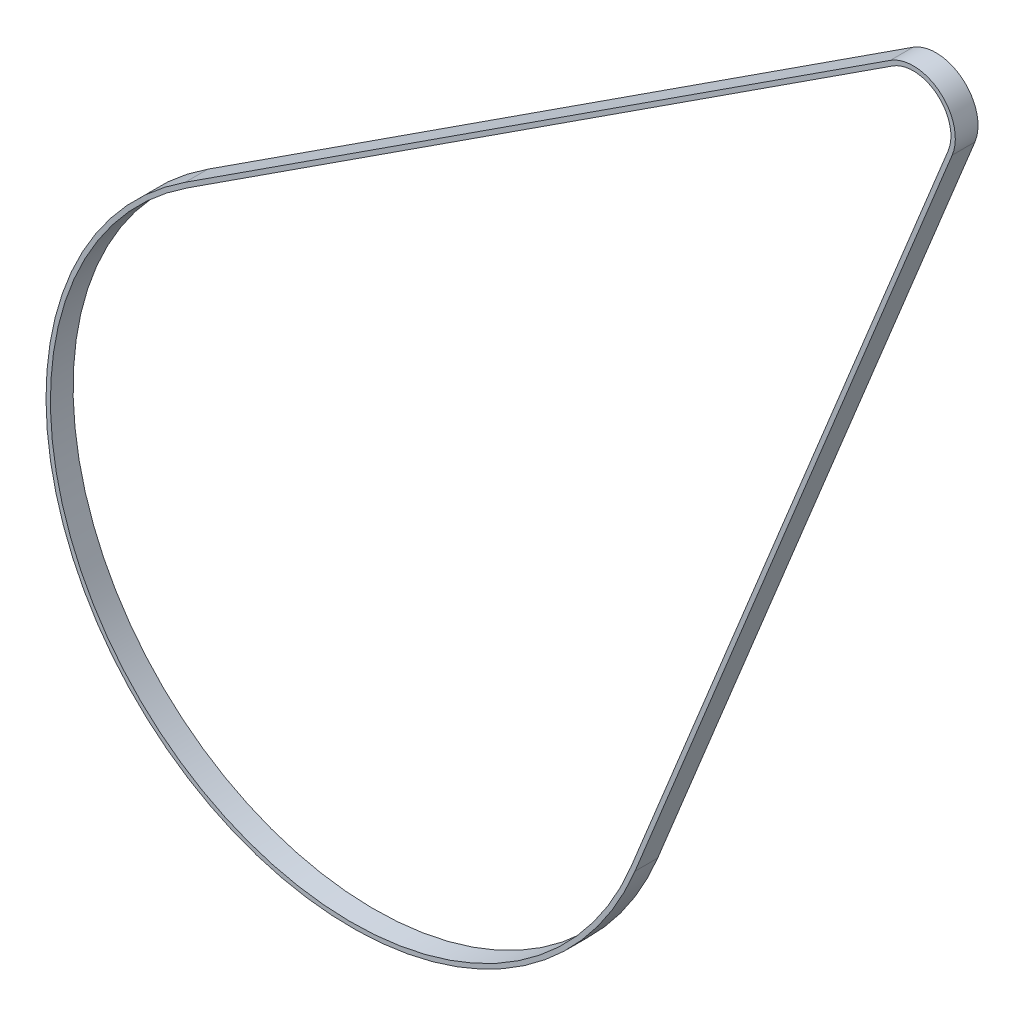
SolidWorks part; units mm, degrees
ref_plane "Front Plane" through (0, 0, 0) normal (0, 0, 1) x (1, 0, 0)
ref_plane "Top Plane" through (0, 0, 0) normal (0, 1, 0) x (1, 0, 0)
ref_plane "Right Plane" through (0, 0, 0) normal (1, 0, 0) x (0, 0, -1)
sketch "Sketch1" plane through (0, 0, 32.5) normal (0, 0, 1) x (1, 0, 0)
  line L0 (6.845, -110.4726) -> (43.0398, -21.6222)
  line L1 (-43.7348, -68.6659) -> (36.7148, -16.3943)
  arc A0 (43.0398, -21.6222) -> (36.7148, -16.3943) centre (39.0576, -20) ccw
  arc A1 (-43.7348, -68.6659) -> (6.845, -110.4726) centre (-25, -97.5) ccw
  circle A2 centre (-25, -97.5) radius 34.386 construction
  point P1 (39.0576, -20)
  point P4 (-25, -97.5)
  dimension "D2" = 8.6
extrude "Extrude-Thin1" add sketch "Sketch1" along normal mid plane 2.59 from offset 2.08 thin
